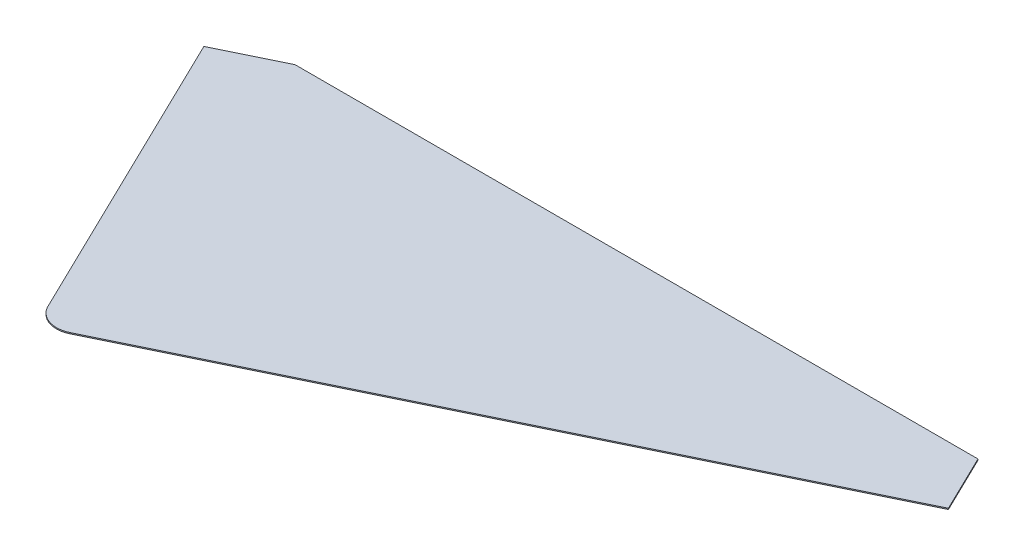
SolidWorks part; units mm, degrees
ref_plane "Front Plane" through (0, 0, 0) normal (1, 0, 0) x (0, 1, 0)
ref_plane "Top Plane" through (0, 0, 0) normal (0, 0, 1) x (0, 1, 0)
ref_plane "Right Plane" through (0, 0, 0) normal (0, 1, 0) x (-1, 0, 0)
sketch "Sketch1" plane through (0, 0, 0) normal (0, 1, 0) x (-1, 0, 0)
  point P0 (0, 0)
  point P6 (331.0861, 50.3104)
  line B0 (184.5189, 294.4661) -> (189.017, 296.6496)
  line B1 (183.1324, 297.3223) -> (187.6305, 299.5058)
  line B2 (221.0381, 287.9331) -> (347.6806, 27.0467)
  line B3 (336.1078, -6.361) -> (276.8911, -35.1066)
  line B4 (274.1136, -43.1244) -> (276.1367, -47.2921)
  line B5 (285.4623, -49.2074) -> (324.5825, -15.3284)
  line B6 (218.1819, 286.5465) -> (344.8243, 25.6602)
  line B7 (334.7213, -3.5047) -> (275.5046, -32.2504)
  line B8 (271.2574, -44.511) -> (273.2805, -48.6786)
  line B9 (287.5408, -51.6075) -> (332.8966, -12.3283)
  line B10 (332.7442, -12.1524) -> (332.8966, -12.3283)
  line B11 (183.1324, 297.3223) -> (184.5189, 294.4661)
  line B12 (331.5516, -11.9075) -> (324.8004, -15.1847)
  arc B13 (187.6305, 299.5058) -> (221.0381, 287.9331) centre (198.5479, 277.0156) cw
  arc B14 (347.6806, 27.0467) -> (336.1078, -6.361) centre (325.1904, 16.1292) cw
  arc B15 (276.8911, -35.1066) -> (274.1136, -43.1244) centre (279.5113, -40.5043) ccw
  arc B16 (276.1367, -47.2921) -> (285.4623, -49.2074) centre (281.5344, -44.6719) ccw
  arc B17 (189.017, 296.6496) -> (218.1819, 286.5465) centre (198.5479, 277.0156) cw
  arc B18 (344.8243, 25.6602) -> (334.7213, -3.5047) centre (325.1904, 16.1292) cw
  arc B19 (275.5046, -32.2504) -> (271.2574, -44.511) centre (279.5113, -40.5043) ccw
  arc B20 (273.2805, -48.6786) -> (287.5408, -51.6075) centre (281.5344, -44.6719) ccw
  arc B21 (324.5825, -15.3284) -> (324.8004, -15.1847) centre (325.2371, -16.0843) cw
  arc B22 (331.5516, -11.9075) -> (332.7442, -12.1524) centre (331.9883, -12.8071) cw
  line B23 (184.5189, 294.4661) -> (-318.362, 50.3518)
  line B24 (-347.3371, 105.4614) -> (-266.4443, -61.1797)
  line B25 (395.7629, 48.3587) -> (254.73, -20.1031)
  line B26 (208.5373, 244.9876) -> (-294.3436, 0.8734)
  line B27 (205.906, 185.89) -> (296.7951, -1.3437)
  line B28 (-296.1428, 0) -> (296.1428, 0)
sketch_block_instance "Block2-1"
sketch_block "Block2" parameters "D1"=559, "D2"=93, "D3"=20, "D5"=55, "D4"=55
sketch_block_instance "Block1-1"
sketch_block "Block1"
sketch "Sketch2" plane through (0, 0, 0) normal (0, 1, 0) x (-1, 0, 0)
  line L6 (-320.1612, 49.4784) -> (-296.1428, 0)
  line L7 (-296.1428, 0) -> (291.9637, 0)
  line L8 (291.9637, 0) -> (344.8243, 25.6602)
  line L9 (395.7629, 48.3587) -> (254.73, -20.1031) construction
  line L10 (344.8243, 25.6602) -> (218.1819, 286.5465)
  line L11 (189.017, 296.6496) -> (-320.1612, 49.4784)
  arc A2 (189.017, 296.6496) -> (218.1819, 286.5465) centre (198.5479, 277.0156) cw
  arc A3 (218.1819, 286.5465) -> (189.017, 296.6496) centre (198.5479, 277.0156) ccw construction
  point P16 (0, 0)
  point P17 (188.5991, 296.4467)
extrude "Boss-Extrude1" add sketch "Sketch2" along normal blind 1
